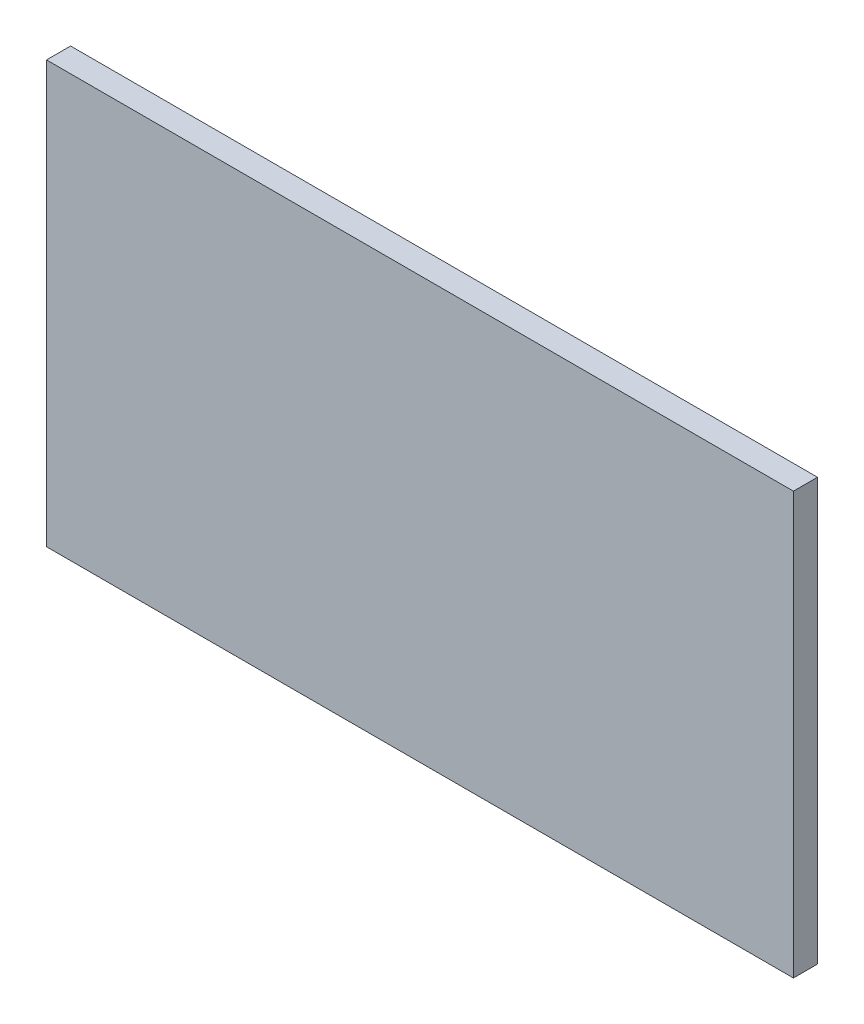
SolidWorks part; units mm, degrees
ref_plane "Plan de face" through (0, 0, 0) normal (0, 0, 1) x (1, 0, 0)
ref_plane "Plan de dessus" through (0, 0, 0) normal (0, 1, 0) x (1, 0, 0)
ref_plane "Plan de droite" through (0, 0, 0) normal (1, 0, 0) x (0, 0, -1)
sketch "Esquisse1" plane through (0, 0, 0) normal (0, 0, 1) x (1, 0, 0)
  line L1 (-310, -175) -> (310, -175)
  line L2 (-310, -175) -> (-310, 175)
  line L3 (-310, 175) -> (310, 175)
  line L4 (310, -175) -> (310, 175)
  line L5 (-310, -175) -> (310, 175) construction
  line L6 (-310, 175) -> (310, -175) construction
  point P0 (0, 0)
  dimension "D1" = 350
  dimension "D2" = 620
extrude "Boss.-Extru.1" add sketch "Esquisse1" along normal mid plane 20
